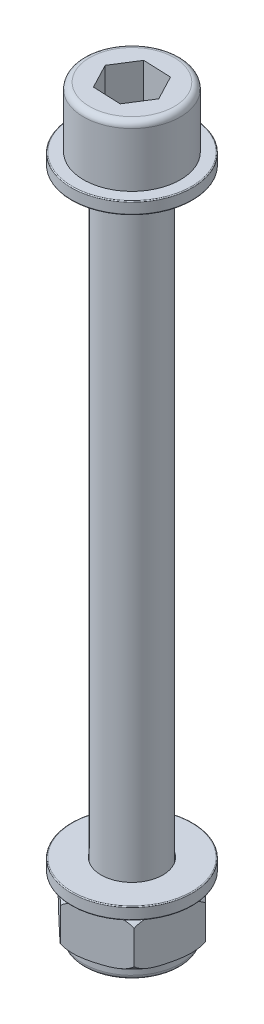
SolidWorks part; units mm, degrees
ref_plane "Plan de face" through (0, 0, 0) normal (0, 0, 1) x (1, 0, 0)
ref_plane "Plan de dessus" through (0, 0, 0) normal (0, 1, 0) x (1, 0, 0)
ref_plane "Plan de droite" through (0, 0, 0) normal (1, 0, 0) x (0, 0, -1)
sketch "Esquisse1" plane through (0, 0, 0) normal (0, 0, 1) x (1, 0, 0)
  line L0 (0, 0) -> (0, -115)
  line L1 (0, -115) -> (-4.4, -115)
  line L2 (-4.4, -115) -> (-5, -114.4)
  line L3 (-5, -114.4) -> (-5, 0)
  line L4 (-6, 10) -> (-7, 10)
  line L5 (-8, 0) -> (-8, 9)
  line L6 (-6, 10) -> (-6, 3.4641)
  line L7 (-6, 3.4641) -> (0, 0)
  line L8 (-8, 0) -> (-5, 0)
  arc A0 (-7, 10) -> (-8, 9) centre (-7, 9) ccw
  dimension "D5" = 10
  dimension "D7" = 115
  dimension "D3" = 1
  dimension "D1" = 60
  dimension "D2" = 5
  dimension "D4" = 6
  dimension "D6" = 8
  dimension "D8" = 45
  dimension "D9" = 0.6
  dimension "D10" = 10
revolve "Révolution1" add sketch "Esquisse1" angle 360 about L0
sketch "Esquisse2" plane through (0, 10, 0) normal (0, 1, 0) x (1, 0, 0)
  line L1 (-2.1473, 4.0893) -> (-4.6151, 0.185)
  line L2 (-4.6151, 0.185) -> (-2.4678, -3.9043)
  line L3 (-2.4678, -3.9043) -> (2.1473, -4.0893)
  line L4 (2.1473, -4.0893) -> (4.6151, -0.185)
  line L5 (4.6151, -0.185) -> (2.4678, 3.9043)
  line L6 (2.4678, 3.9043) -> (-2.1473, 4.0893)
  circle A0 centre (0, 0) radius 4 construction
  circle A2 centre (0, 0) radius 7
  dimension "D2" = 8
  dimension "D1" = 14
extrude "Boss.-Extru.1" add sketch "Esquisse2" against normal up to surface (10 mm away)
sketch "Esquisse4" plane through (0, 0, 0) normal (0, 0, 1) x (1, 0, 0)
  line L0 (0, 0) -> (0, -18.2878) construction
  line L1 (5.1, -101) -> (9.85, -101)
  line L2 (5.1, -101) -> (5.1, -103)
  line L3 (5.1, -103) -> (9.85, -103)
  line L4 (10, -101.15) -> (10, -102.85)
  arc A0 (9.85, -103) -> (10, -102.85) centre (9.85, -102.85) ccw
  arc A1 (9.85, -101) -> (10, -101.15) centre (9.85, -101.15) cw
  dimension "D4" = 0.15
  dimension "D1" = 5.1
  dimension "D2" = 2
  dimension "D3" = 10
  dimension "D5" = 101
revolve "Révolution2" add sketch "Esquisse4" angle 360 about L0
sketch "Esquisse3" plane through (0, 0, 0) normal (0, 0, 1) x (1, 0, 0)
  line L0 (5, -114.4) -> (5, 0) construction
  line L1 (5.25, -103) -> (8, -103)
  line L2 (5, -103.25) -> (5, -112.8)
  line L3 (0, 0) -> (0, -17.1274) construction
  line L4 (8, -103) -> (8, -111) construction
  line L5 (6.5, -113) -> (6.5, -112.8)
  line L6 (5, -103.25) -> (5.25, -103)
  line L7 (8, -111.2758) -> (8, -112.25)
  line L8 (7.25, -113) -> (6.5, -113)
  line L9 (-9.85, -103) -> (9.85, -103) construction
  line L10 (6.5, -112.8) -> (5, -112.8)
  line L11 (10.5, -107) -> (8, -107) construction
  line L12 (8, -107) -> (5.5, -107) construction
  arc A0 (8, -111.2758) -> (8.252, -110.9796) centre (8.3, -111.2758) cw
  arc A1 (8, -112.25) -> (7.25, -113) centre (7.25, -112.25) cw
  ellipse E0 centre (8, -107) end of major axis (8, -103) minor radius 2.5 (8.252, -110.9796) -> (8, -103) ccw
  point P0 (5, -103)
  point P15 (8, -113)
  dimension "D6" = 0.75
  dimension "D7" = 3
  dimension "D8" = 0.3
  dimension "D1" = 8
  dimension "D2" = 10
  dimension "D3" = 8
  dimension "D4" = 9.8
  dimension "D5" = 1.5
  dimension "D10" = 2.5
revolve "Révolution3" add sketch "Esquisse3" angle 360 about L3
sketch "Esquisse5" plane through (0, -101, 0) normal (0, 1, 0) x (1, 0, 0)
  line L1 (-9.4108, -2.7876) -> (-2.2913, -9.5438)
  line L2 (-2.2913, -9.5438) -> (7.1195, -6.7562)
  line L3 (7.1195, -6.7562) -> (9.4108, 2.7876)
  line L4 (9.4108, 2.7876) -> (2.2913, 9.5438)
  line L5 (2.2913, 9.5438) -> (-7.1195, 6.7562)
  line L6 (-7.1195, 6.7562) -> (-9.4108, -2.7876)
  circle A0 centre (0, 0) radius 8.5 construction
  circle A1 centre (0, 0) radius 14.4907
  dimension "D1" = 17
extrude "Enlèv. mat.-Extru.1" cut sketch "Esquisse5" against normal blind 10
pattern_linear "Répétition linéaire1" count 2 spacing 101 along (0, 1, 0)
fillet "Congé1" radius 0.5 1 edges at (0, -113, 6.5)
